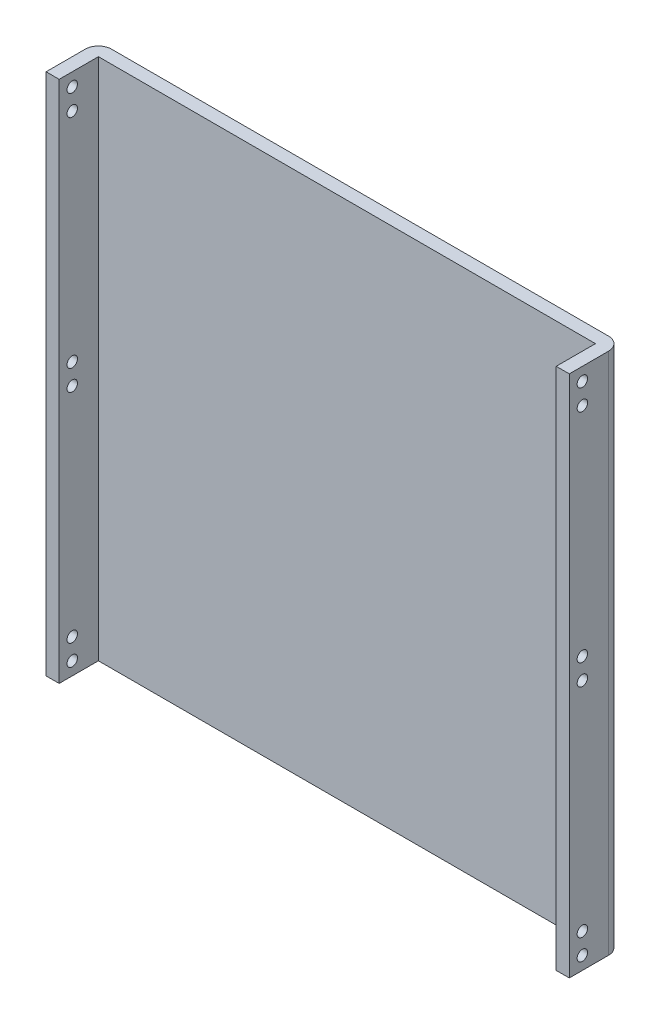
SolidWorks part; units mm, degrees
ref_plane "Front Plane" through (0, 0, 0) normal (0, 0, 1) x (1, 0, 0)
ref_plane "Top Plane" through (0, 0, 0) normal (0, 1, 0) x (1, 0, 0)
ref_plane "Right Plane" through (0, 0, 0) normal (1, 0, 0) x (0, 0, -1)
sketch "Sketch3" plane through (0, 0, 0) normal (0, 1, 0) x (1, 0, 0)
  line L0 (95, 0) -> (-95, 0)
  line L1 (-100, -5) -> (-100, -20)
  line L2 (0, 44.6929) -> (0, -31.7837) construction
  line L3 (100, -5) -> (100, -20)
  line L4 (95, -5) -> (95, -20)
  line L5 (95, -5) -> (-95, -5)
  line L6 (-95, -5) -> (-95, -20)
  line L7 (-100, -20) -> (-95, -20)
  line L8 (95, -20) -> (100, -20)
  arc A0 (-95, 0) -> (-100, -5) centre (-95, -5) ccw
  arc A1 (95, 0) -> (100, -5) centre (95, -5) cw
  arc A2 (95, -5) -> (95, -5) centre (95, -5) cw
  arc A3 (-95, -5) -> (-95, -5) centre (-95, -5) ccw
  point P0 (100, 0)
  point P6 (-100, 0)
  point P13 (0, 0)
  dimension "D3" = 5
  dimension "D1" = 100
  dimension "D2" = 20
  dimension "D4" = 5
extrude "Boss-Extrude1" add sketch "Sketch3" along normal mid plane 200
sketch "Sketch4" plane through (-100, 0, 0) normal (-1, 0, 0) x (0, 0, 1)
  line L0 (15, 100) -> (15, -100) construction
  line L1 (5, 100) -> (20, 100) construction
  line L2 (5, -100) -> (20, -100) construction
  line L3 (20, 100) -> (20, -100) construction
  line L4 (0, 0) -> (50.0739, 0) construction
  circle A0 centre (15, 95) radius 2
  circle A1 centre (15, 87) radius 2
  circle A2 centre (15, 4) radius 2
  circle A3 centre (15, -4) radius 2
  circle A4 centre (15, -95) radius 2
  circle A5 centre (15, -87) radius 2
  dimension "D1" = 4
  dimension "D3" = 8
  dimension "D4" = 4
  dimension "D5" = 8
  dimension "D6" = 5
  dimension "D2" = 5
extrude "Cut-Extrude1" cut sketch "Sketch4" against normal blind 214
